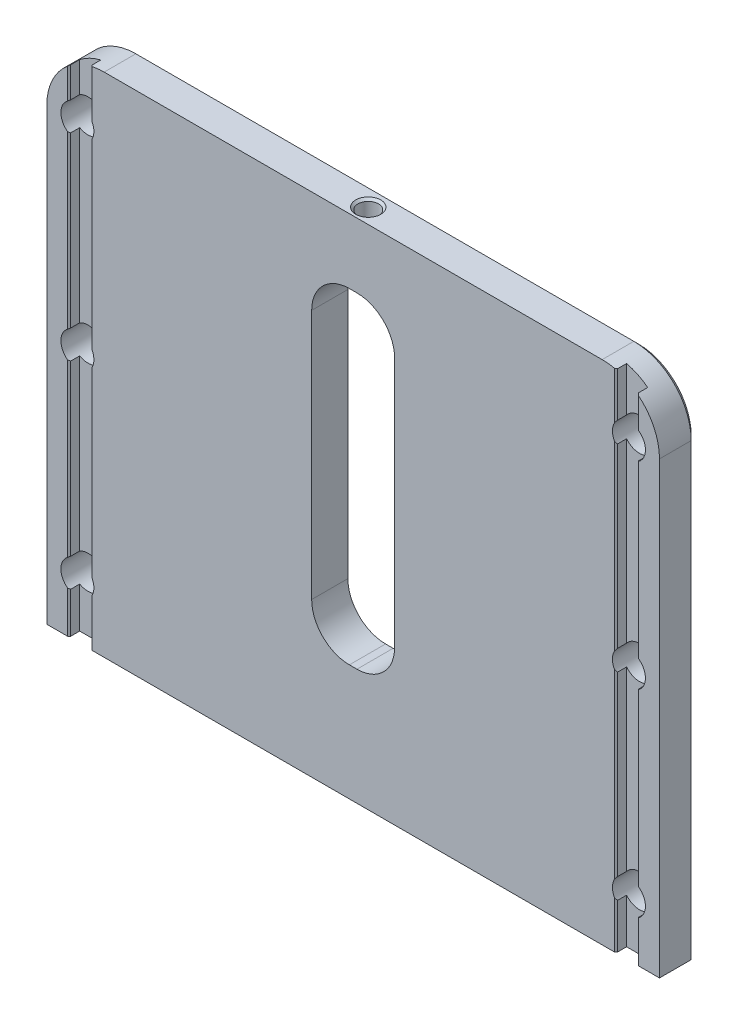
SolidWorks part; units mm, degrees
ref_plane "Front Plane" through (0, 0, 0) normal (0, 0, 1) x (1, 0, 0)
ref_plane "Top Plane" through (0, 0, 0) normal (0, 1, 0) x (1, 0, 0)
ref_plane "Right Plane" through (0, 0, 0) normal (1, 0, 0) x (0, 0, -1)
imported_body "Imported1"
sketch "Sketch1" plane through (0, 0, -16.256) normal (0, 0, 1) x (1, 0, 0)
  line L0 (-46.4312, 76.073) -> (-46.4312, 42.799) construction
  line L1 (0, 71.504) -> (0, -3.8525) construction
  line L2 (41.9227, 85.598) -> (-41.9227, 85.598) construction
  circle A0 centre (-46.4312, 42.799) radius 2.7781
  circle A1 centre (-46.4312, 76.073) radius 2.7781 construction
  circle A2 centre (46.4312, 42.799) radius 2.7781
  dimension "D1" = 42.799
extrude "Cut-Extrude1" cut sketch "Sketch1" against normal through all
